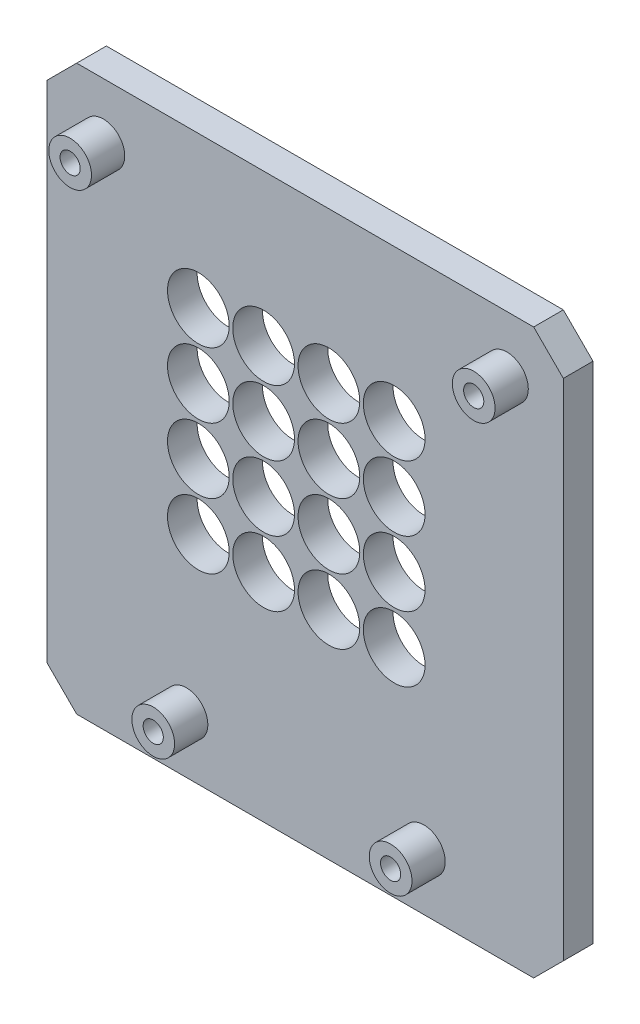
SolidWorks part; units mm, degrees
ref_plane "前视基准面" through (0, 0, 0) normal (0, 0, 1) x (1, 0, 0)
ref_plane "上视基准面" through (0, 0, 0) normal (0, 1, 0) x (1, 0, 0)
ref_plane "右视基准面" through (0, 0, 0) normal (1, 0, 0) x (0, 0, -1)
other "Configuration Table"
sketch "草图1" plane through (0, 0, 0) normal (0, 0, 1) x (1, 0, 0)
  line L0 (-37, -53) -> (40, -53)
  line L1 (40, -53) -> (45, -48)
  line L2 (45, -48) -> (45, 37)
  line L3 (45, 37) -> (40, 42)
  line L4 (40, 42) -> (-37, 42)
  line L5 (-37, 42) -> (-42, 37)
  line L6 (-42, 37) -> (-42, -48)
  line L7 (-42, -48) -> (-37, -53)
  circle A0 centre (-16.5, -16.5) radius 5.2
  circle A1 centre (-5.5, -16.5) radius 5.2
  circle A2 centre (5.5, -16.5) radius 5.2
  circle A3 centre (16.5, -16.5) radius 5.2
  circle A4 centre (-16.5, -5.5) radius 5.2
  circle A5 centre (-5.5, -5.5) radius 5.2
  circle A6 centre (5.5, -5.5) radius 5.2
  circle A7 centre (16.5, -5.5) radius 5.2
  circle A8 centre (-16.5, 5.5) radius 5.2
  circle A9 centre (-5.5, 5.5) radius 5.2
  circle A10 centre (5.5, 5.5) radius 5.2
  circle A11 centre (16.5, 5.5) radius 5.2
  circle A12 centre (-16.5, 16.5) radius 5.2
  circle A13 centre (-5.5, 16.5) radius 5.2
  circle A14 centre (5.5, 16.5) radius 5.2
  circle A15 centre (16.5, 16.5) radius 5.2
  circle A16 centre (-32.5, 32.5) radius 1.7
  circle A17 centre (35.5, 32.5) radius 1.7
  circle A18 centre (-18.5, -43.5) radius 1.7
  circle A19 centre (21.5, -43.5) radius 1.7
  dimension "D1" = 3.4
  dimension "D2" = 10.4
  dimension "D3" = 5.5
  dimension "D4" = 16.5
  dimension "D5" = 21.5
  dimension "D6" = 35.5
  dimension "D7" = 40
  dimension "D8" = 45
  dimension "D9" = 5.5
  dimension "D10" = 16.5
  dimension "D11" = 18.5
  dimension "D12" = 32.5
  dimension "D13" = 37
  dimension "D14" = 5.5
  dimension "D15" = 16.5
  dimension "D16" = 32.5
  dimension "D17" = 37
  dimension "D18" = 42
  dimension "D19" = 5.5
  dimension "D20" = 16.5
  dimension "D21" = 43.5
  dimension "D22" = 48
extrude "Guide_16_bores_pitch11" add sketch "草图1" along normal blind 5
sketch "草图2" plane through (0, 0, 0) normal (0, 0, 1) x (1, 0, 0)
  circle A0 centre (-32.5, 32.5) radius 3.6
  circle A1 centre (-32.5, 32.5) radius 1.7
  circle A2 centre (35.5, 32.5) radius 3.6
  circle A3 centre (35.5, 32.5) radius 1.7
  circle A4 centre (-18.5, -43.5) radius 3.6
  circle A5 centre (-18.5, -43.5) radius 1.7
  circle A6 centre (21.5, -43.5) radius 3.6
  circle A7 centre (21.5, -43.5) radius 1.7
  dimension "D1" = 3.4
  dimension "D2" = 7.2
  dimension "D3" = 21.5
  dimension "D4" = 35.5
  dimension "D5" = 18.5
  dimension "D6" = 32.5
  dimension "D7" = 32.5
  dimension "D8" = 43.5
extrude "PCB_front_datum_10p6" add sketch "草图2" along normal blind 5.6 from offset 5
